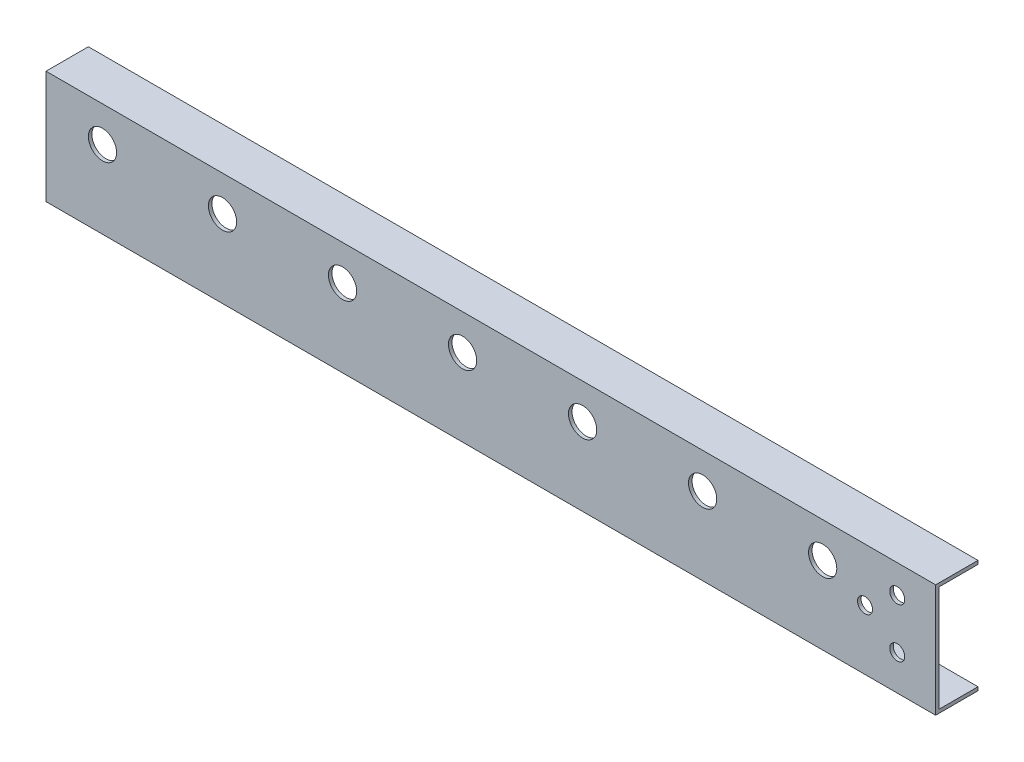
SolidWorks part; units mm, degrees
other "<pivot_rh_rail1>-<Cut-Extrude2>"
ref_plane "Plane1" through (0, 0, 0) normal (0, 0, 1) x (1, 0, 0)
ref_plane "Plane2" through (0, 0, 0) normal (0, 1, 0) x (1, 0, 0)
ref_plane "Plane3" through (0, 0, 0) normal (1, 0, 0) x (0, 0, -1)
mirrored part "pivot_rh_rail1_Mirrored"
